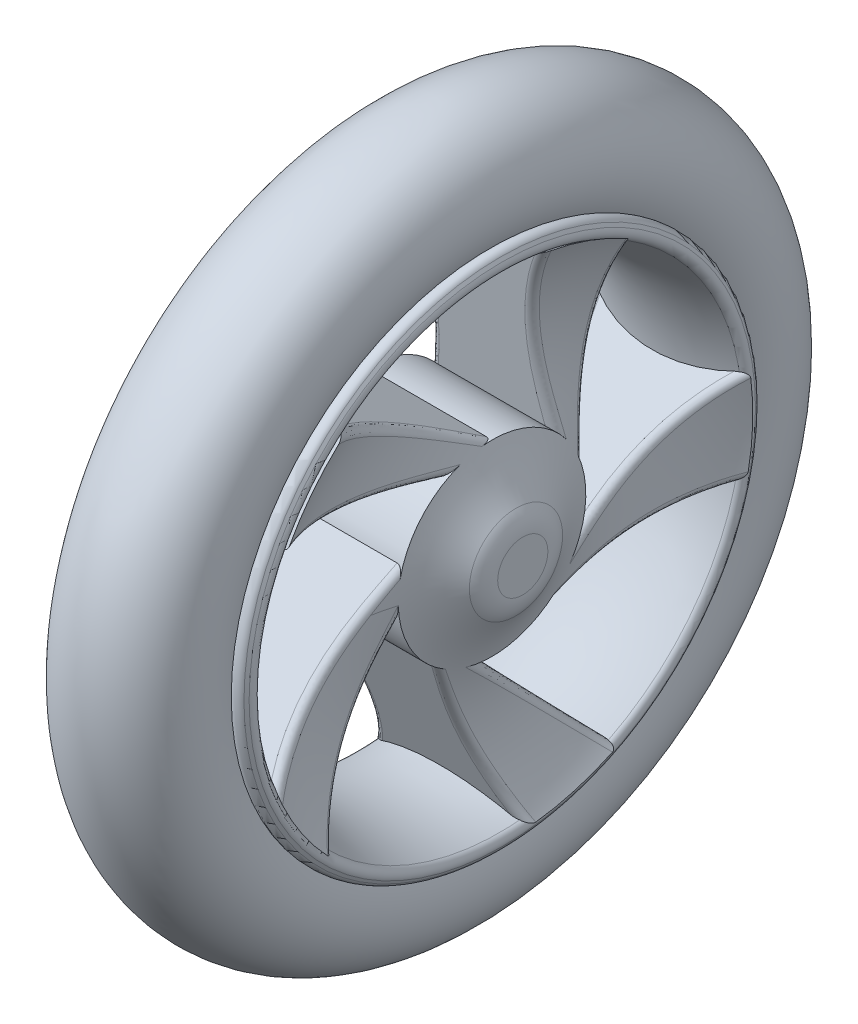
SolidWorks part; units mm, degrees
ref_plane "Front Plane" through (0, 0, 0) normal (0, 0, 1) x (1, 0, 0)
ref_plane "Top Plane" through (0, 0, 0) normal (0, 1, 0) x (1, 0, 0)
ref_plane "Right Plane" through (0, 0, 0) normal (1, 0, 0) x (0, 0, -1)
sketch "Sketch1" plane through (0, 0, 0) normal (0, 0, 1) x (1, 0, 0)
  line L0 (0, 70) -> (0, 0) construction
  line L1 (-18.0278, 70) -> (-20.6032, 65.7143)
  line L2 (18.0278, 70) -> (20.6032, 65.7143)
  line L3 (-55.4619, 0) -> (107.2607, 0) construction
  arc A0 (-18.0278, 70) -> (18.0278, 70) centre (0, 100) ccw
  arc A1 (-20.6032, 65.7143) -> (20.6032, 65.7143) centre (0, 100) ccw
  dimension "D1" = 35
  dimension "D2" = 70
  dimension "D3" = 30
  dimension "D4" = 5
revolve "Revolve1" add sketch "Sketch1" angle 360 about L3
fillet "Fillet1" radius 2 4 edges at (-20.6032, 0, 65.7143) (20.6032, 0, 65.7143) (18.0278, 0, 70) (-18.0278, 0, 70)
sketch "Sketch2" plane through (0, 0, 0) normal (0, 1, 0) x (1, 0, 0)
  line L0 (-41.3094, 0) -> (46.6856, 0) construction
  arc A0 (16.3798, -69.0694) -> (-16.3798, -69.0694) centre (0, -100) ccw construction
  arc A1 (16.3798, -69.0694) -> (-16.3798, -69.0694) centre (0, -100) ccw
  arc A2 (-16.3798, -69.0694) -> (16.3798, -69.0694) centre (0, -76.5328) ccw
  dimension "D1" = 18
revolve "Revolve2" add sketch "Sketch2" angle 360 about L0
sketch "Sketch5" plane through (0, 0, 0) normal (0, 0, 1) x (1, 0, 0)
  line L0 (-36.1547, 0) -> (46.0744, 0) construction
  line L1 (-25, 10) -> (-25, 0)
  line L2 (0, 81.598) -> (0, 0) construction
  line L3 (25, 10) -> (25, 0)
  line L4 (-25, 0) -> (25, 0)
  arc A0 (-20.6032, 65.7143) -> (20.6032, 65.7143) centre (0, 100) ccw construction
  arc A1 (-20.6032, 65.7143) -> (20.6032, 65.7143) centre (0, 100) ccw
  arc A2 (-20.6032, 65.7143) -> (-25, 10) centre (-64.1357, 41.1191) cw
  arc A3 (20.6032, 65.7143) -> (25, 10) centre (64.1357, 41.1191) ccw
  dimension "D1" = 50
  dimension "D2" = 10
  dimension "D3" = 25
revolve "Revolve3" add sketch "Sketch5" angle 360 about L4
sketch "Sketch3" plane through (0, 0, 0) normal (1, 0, 0) x (0, 0, -1)
  line L0 (0, 44.7645) -> (0, -39.176) construction
  line L1 (0, 25) -> (-42.9075, 49.7726)
  line L2 (0, 25) -> (21.8344, 25) construction
  line L3 (0, 0) -> (-12.5, 21.6506) construction
  line L4 (-12.5, 21.6506) -> (-58.5812, 29.776)
  line L5 (-24.9536, 21.6506) -> (-4.7025, 21.6506) construction
  line L6 (23.7764, 7.7254) -> (34.0775, 56.188)
  line L7 (16.7283, 18.5786) -> (10.2161, 64.9153)
  line L8 (14.6946, -20.2254) -> (63.9685, -15.0465)
  line L9 (22.8386, -10.1684) -> (64.8951, 10.3439)
  line L10 (-14.6946, -20.2254) -> (5.4573, -65.4873)
  line L11 (-2.6132, -24.863) -> (29.8913, -58.5225)
  line L12 (-23.7764, 7.7254) -> (-60.5957, -25.4268)
  line L13 (-24.4537, -5.1978) -> (-46.4212, -46.5127)
  arc A0 (16.7283, 18.5786) -> (0, 25) centre (0, 0) ccw
  arc A3 (10.2161, 64.9153) -> (-42.9075, 49.7726) centre (0, 0) ccw
  arc A8 (-12.5, 21.6506) -> (-23.7764, 7.7254) centre (0, 0) ccw
  arc A9 (-24.4537, -5.1978) -> (-14.6946, -20.2254) centre (0, 0) ccw
  arc A10 (-2.6132, -24.863) -> (14.6946, -20.2254) centre (0, 0) ccw
  arc A11 (22.8386, -10.1684) -> (23.7764, 7.7254) centre (0, 0) ccw
  circle A12 centre (0, 0) radius 65.7143 construction
  arc A13 (-58.5812, 29.776) -> (-60.5957, -25.4268) centre (0, 0) ccw
  arc A14 (64.8951, 10.3439) -> (34.0775, 56.188) centre (0, 0) ccw
  arc A15 (29.8913, -58.5225) -> (63.9685, -15.0465) centre (0, 0) ccw
  arc A16 (-46.4212, -46.5127) -> (5.4573, -65.4873) centre (0, 0) ccw
  dimension "D1" = 50
  dimension "D2" = 30
  dimension "D3" = 30
  dimension "D4" = 10
  dimension "D5" = 5
extrude "Cut-Extrude1" cut sketch "Sketch3" against normal through all both and the other way through all
fillet "Fillet4" radius 10 2 edges at (25, 0, 10) (-25, 0, 10)
fillet "Fillet6" radius 2 20 edges at (14.8966, -31.6074, 38.4959) (14.2094, -43.6241, 4.2769) (-14.9449, -50.0586, 1.4121) (-14.3751, -43.3943, -15.2822) (14.8966, -46.379, -18.1645) (14.2094, -17.5481, -40.1674) (-14.9449, -16.8119, -47.1721) (-14.3751, 1.1247, -45.993) (14.8966, 2.9436, -49.7222) (14.2094, 32.7788, -29.1017) (-14.9449, 39.6682, -30.5661) (-14.3751, 44.0895, -13.1429) (14.8966, 48.1982, -12.5655) (14.2094, 37.8065, 22.1816) (-14.9449, 41.3282, 28.2813) (-14.3751, 26.1241, 37.8703) (14.8966, 26.8446, 41.9563) (14.2094, -9.413, 42.8106) (-14.9449, -14.126, 48.0449) (-14.3751, -27.9439, 36.548)
